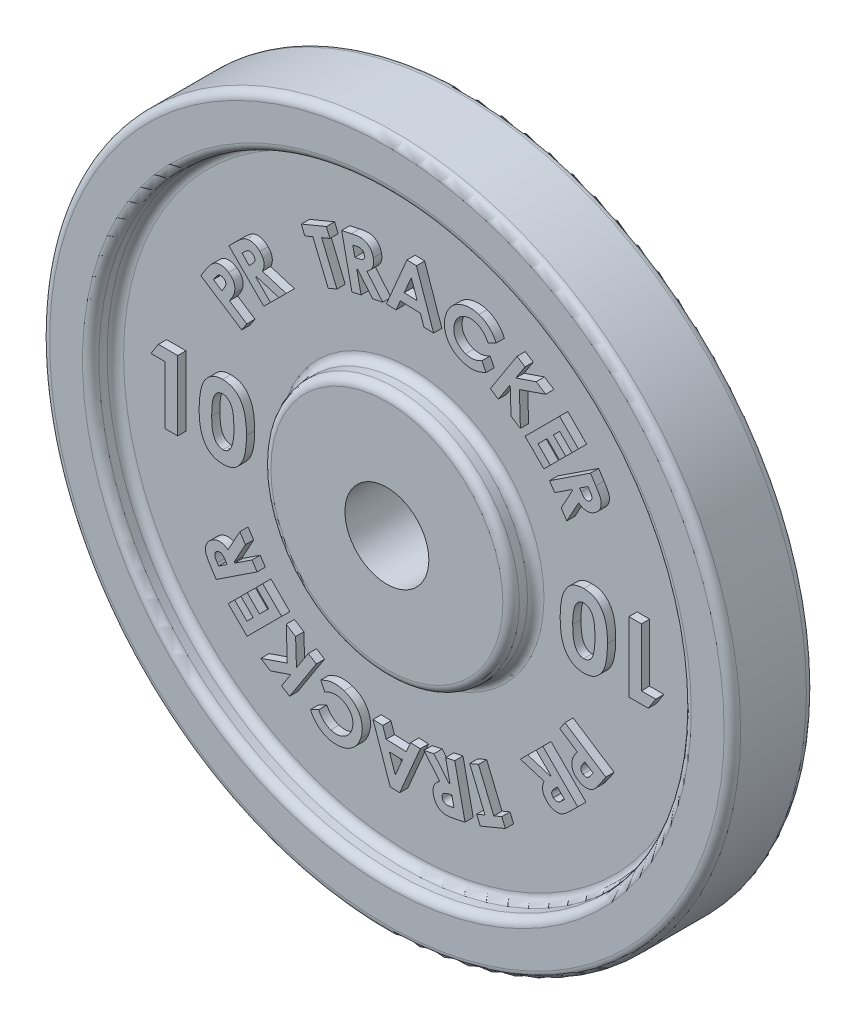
SolidWorks part; units mm, degrees
ref_plane "Plano frontal" through (0, 0, 0) normal (0, 0, 1) x (1, 0, 0)
ref_plane "Plano superior" through (0, 0, 0) normal (0, 1, 0) x (1, 0, 0)
ref_plane "Plano direito" through (0, 0, 0) normal (1, 0, 0) x (0, 0, -1)
sketch "Esboço1" plane through (0, 0, 0) normal (0, 0, 1) x (1, 0, 0)
  circle A0 centre (0, 0) radius 21
  circle A1 centre (0, 0) radius 2.55
  dimension "D1" = 42
  dimension "D2" = 5.1
extrude "Ressalto-extrusão1" add sketch "Esboço1" along normal blind 5
sketch "Esboço2" plane through (0, 0, 5) normal (0, 0, 1) x (1, 0, 0)
  circle A0 centre (0, 0) radius 18
  circle A1 centre (0, 0) radius 21
  circle A2 centre (0, 0) radius 21
  circle A5 centre (0, 0) radius 7.55
  circle A6 centre (0, 0) radius 7.55
  dimension "D1" = 0
  dimension "D2" = 3
  dimension "D3" = 5
extrude "Corte-extrusão1" cut sketch "Esboço2" against normal blind 1.5 contours A0 A6
fillet "Filete1" radius 0.5 4 edges at (7.55, 0, 3.5) (18, 0, 3.5) (7.55, 0, 5) (18, 0, 5)
sketch "Esboço3" plane through (0, 0, 3.5) normal (0, 0, 1) x (1, 0, 0)
  arc A0 (11.25, 0) -> (-11.25, 0) centre (0, 0) ccw construction
  text T0 "<b>PR  TRACKER</b>" font "Century Gothic" height 3
  dimension "D1" = 22.5
extrude "Ressalto-extrusão2" add sketch "Esboço3" along normal blind 0.5
sketch "Esboço5" plane through (0, 0, 3.5) normal (0, 0, 1) x (1, 0, 0)
  line L0 (-17.3735, -2.1) -> (-7.7713, -2.1) construction
  line L1 (0, 0) -> (-17.5, 0) construction
  circle A2 centre (0, 0) radius 17.5 construction
  circle A3 centre (0, 0) radius 8.05 construction
  text T0 "<b>10</b>" font "Century Gothic" height in points 16
  dimension "D1" = 2.1
extrude "Ressalto-extrusão3" add sketch "Esboço5" along normal blind 0.5
pattern_circular "PadrãoCircular1" count 2 over 360 about axis through (0, 0, 5) along (0, 0, 1) of "Ressalto-extrusão2", "Ressalto-extrusão3"
ref_plane "Plano1" through (0, 0, 2.5) normal (0, 0, 1) x (1, 0, 0)
fillet "Filete2" radius 0.5 2 edges at (21, 0, 0) (21, 0, 5)
mirror "Espelhar6" about plane through (0, 0, 2.5) normal (0, 0, 1) of "Corte-extrusão1"
fillet "Filete3" radius 0.5 4 edges at (18, 0, 1.5) (7.55, 0, 0) (18, 0, 0) (7.55, 0, 1.5)
sketch "Esboço10" plane through (0, 0, 1.5) normal (0, 0, -1) x (-1, 0, 0)
  line L0 (-11.25, 0) -> (11.25, 0) construction
  arc A0 (11.25, 0) -> (-11.25, 0) centre (0, 0) ccw construction
  text T0 "<b>PR  TRACKER</b>" font "Century Gothic" height 3
  dimension "D1" = 22.5
extrude "Ressalto-extrusão4" add sketch "Esboço10" along normal blind 0.5
sketch "Esboço12" plane through (0, 0, 1.5) normal (0, 0, -1) x (-1, 0, 0)
  line L0 (-17.3735, -2.1) -> (-7.2521, -2.1) construction
  circle A0 centre (0, 0) radius 17.5 construction
  circle A1 centre (0, 0) radius 7.55 construction
  text T0 "<b>10</b>" font "Century Gothic" height in points 16
  dimension "D1" = 2.1
extrude "Ressalto-extrusão5" add sketch "Esboço12" along normal blind 0.5
pattern_circular "PadrãoCircular2" count 2 over 360 about axis through (0, 0, 0) along (0, 0, 1) of "Ressalto-extrusão4", "Ressalto-extrusão5"
